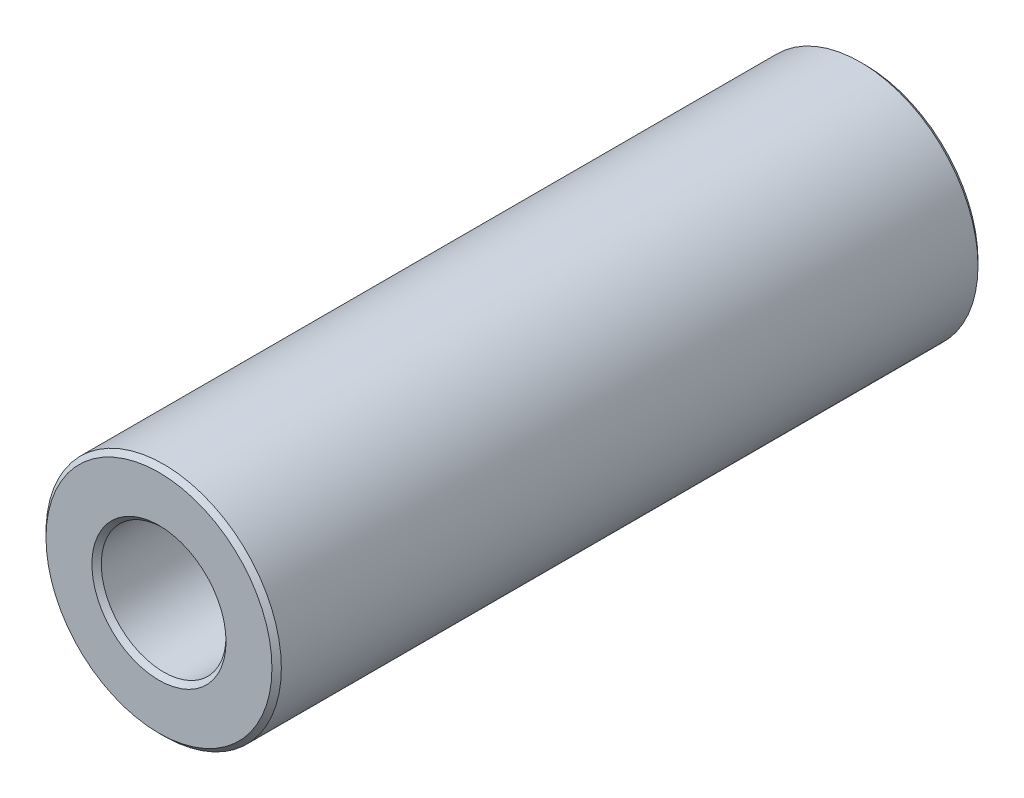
SolidWorks part; units mm, degrees
ref_plane "Front Plane" through (0, 0, 0) normal (0, 0, 1) x (1, 0, 0)
ref_plane "Top Plane" through (0, 0, 0) normal (0, 1, 0) x (1, 0, 0)
ref_plane "Right Plane" through (0, 0, 0) normal (1, 0, 0) x (0, 0, -1)
sketch "Sketch1" plane through (0, 0, 0) normal (0, 0, 1) x (1, 0, 0)
  circle A0 centre (0, 0) radius 5
  circle A1 centre (0, 0) radius 2.65
  dimension "D1" = 10
  dimension "D2" = 5.3
extrude "Boss-Extrude2" add sketch "Sketch1" along normal mid plane 30
chamfer "Chamfer3" distance 0.2 angle 45 4 edges at (5, 0, 15) (5, 0, -15) (2.65, 0, -15) (2.65, 0, 15)
